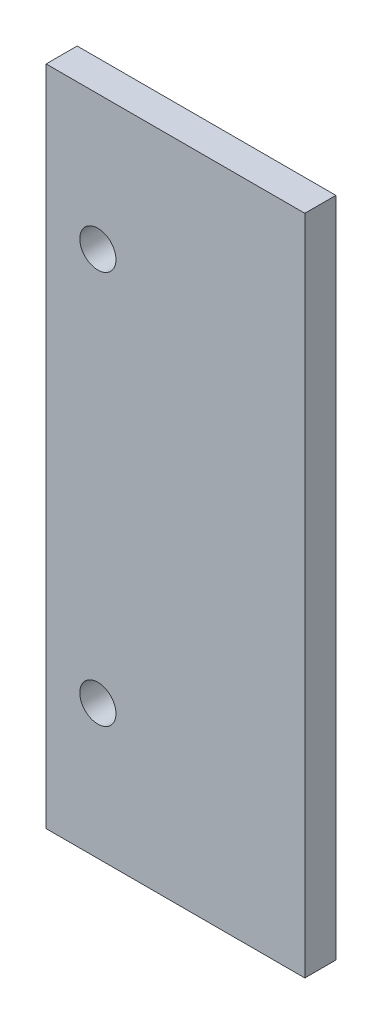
SolidWorks part; units mm, degrees
ref_plane "Front Plane" through (0, 0, 0) normal (0, 0, 1) x (1, 0, 0)
ref_plane "Top Plane" through (0, 0, 0) normal (0, 1, 0) x (1, 0, 0)
ref_plane "Right Plane" through (0, 0, 0) normal (1, 0, 0) x (0, 0, -1)
sketch "Sketch1" plane through (0, 0, 0) normal (0, 0, 1) x (1, 0, 0)
  line L0 (25, 32) -> (0, 32) construction
  line L1 (0, 0) -> (25, 0)
  line L2 (0, 0) -> (0, 64)
  line L3 (0, 64) -> (25, 64)
  line L4 (25, 0) -> (25, 64)
  line L5 (5, 51) -> (5, 13) construction
  circle A0 centre (5, 51) radius 1.75
  circle A1 centre (5, 13) radius 1.75
  dimension "D3" = 3.5
  dimension "D5" = 19
  dimension "D6" = 19
  dimension "D1" = 64
  dimension "D2" = 25
  dimension "D4" = 5
extrude "Extrude1" add sketch "Sketch1" along normal blind 3
